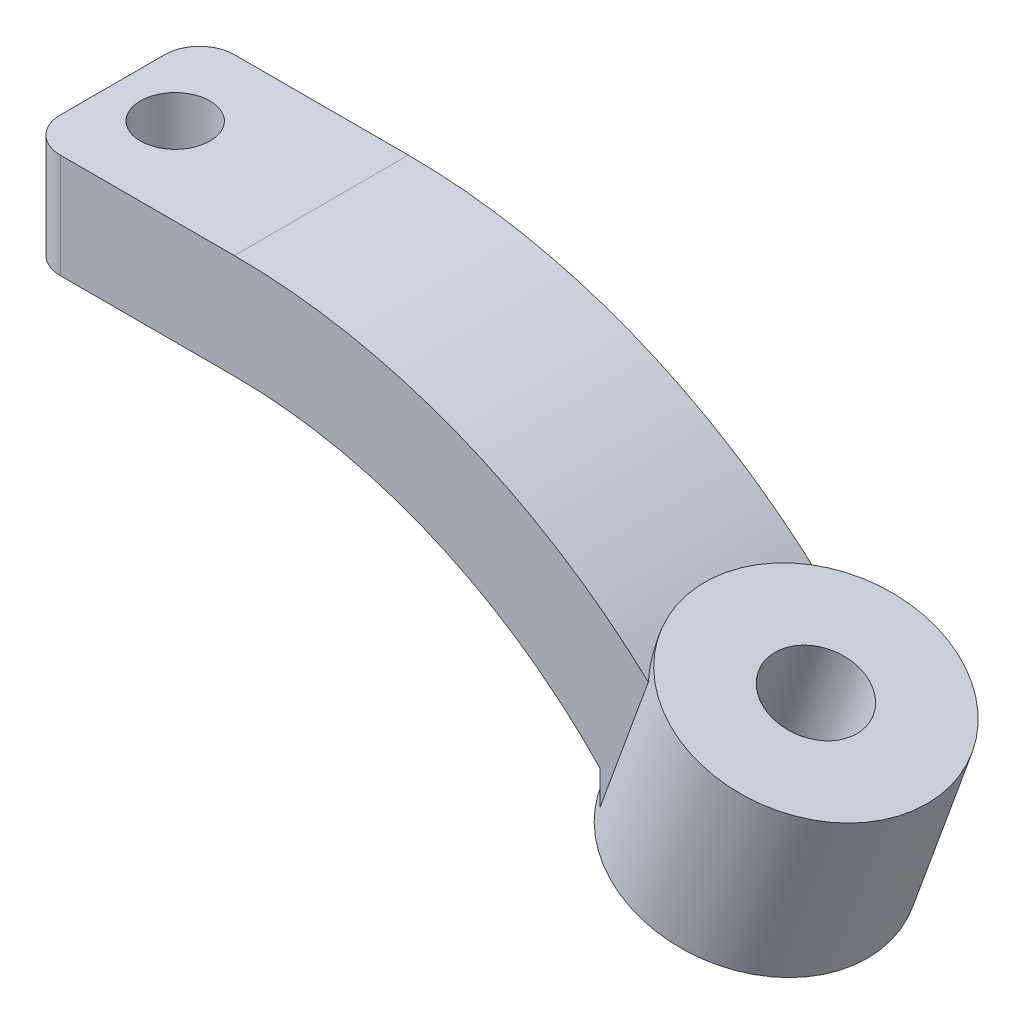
SolidWorks part; units mm, degrees
ref_plane "前视基准面" through (0, 0, 0) normal (0, 0, 1) x (1, 0, 0)
ref_plane "上视基准面" through (0, 0, 0) normal (0, 1, 0) x (1, 0, 0)
ref_plane "右视基准面" through (0, 0, 0) normal (1, 0, 0) x (0, 0, -1)
sketch "草图2" plane through (0, 0, 0) normal (0, 0, 1) x (1, 0, 0)
  line L1 (3, 1.5) -> (-3, 1.5)
  line L2 (3, 1.5) -> (3, -1.5)
  line L3 (3, -1.5) -> (-3, -1.5)
  line L4 (-3, 1.5) -> (-3, -1.5)
  line L5 (3, 1.5) -> (-3, -1.5) construction
  line L6 (3, -1.5) -> (-3, 1.5) construction
  line L7 (17.3634, -6) -> (13.5016, -6)
  arc A0 (3, 1.5) -> (17.3634, -6) centre (3, -16.0037) cw
  arc A1 (3, -1.5) -> (13.5016, -6) centre (3, -16.0037) cw
  arc A2 (3, -1.5) -> (14.9016, -7.7146) centre (3, -16.0037) cw construction
  point P0 (0, 0)
  dimension "D1" = 3
  dimension "D2" = 6
  dimension "D4" = 4.5
  dimension "D3" = 3
extrude "凸台-拉伸1" add sketch "草图2" along normal mid plane 5
sketch "草图4" plane through (0, -1.5, 0) normal (0, -1, 0) x (1, 0, 0)
  line L0 (-3, 2.5) -> (-3, -2.5) construction
  circle A0 centre (-1.2, 0) radius 1
  dimension "D1" = 1.8
  dimension "D2" = 2
extrude "切除-拉伸1" cut sketch "草图4" against normal blind 5
sketch "草图5" plane through (0, 0, 0) normal (0, 0, 1) x (1, 0, 0)
  line L0 (17.6607, -9.0138) -> (13.5016, -7.5)
  line L1 (13.5016, -7.5) -> (13.5016, -6)
  line L2 (13.5016, -6) -> (17.3634, -6)
  line L3 (3, -1.5) -> (-3, -1.5) construction
  arc A0 (17.3634, -6) -> (17.6607, -9.0138) centre (14.3718, -7.8167) cw
  dimension "D3" = 3.5
  dimension "D1" = 20
  dimension "D2" = 1.5
extrude "凸台-拉伸2" add sketch "草图5" along normal mid plane 5
sketch "草图7" plane through (-0.8311, -2.2833, 0) normal (-0.342, -0.9397, 0) x (0.9397, -0.342, 0)
  line L0 (0.008, 0) -> (17.3785, 0) construction
  line L2 (19.6785, 2.5) -> (19.6785, -2.5) construction
  circle A0 centre (17.3785, 0) radius 3.3971
  dimension "D1" = 2.3
extrude "凸台-拉伸3" add sketch "草图7" against normal blind 5
sketch "草图8" plane through (-0.8311, -2.2833, 0) normal (-0.342, -0.9397, 0) x (0.9397, -0.342, 0)
  circle A0 centre (17.3785, 0) radius 1.25
  dimension "D1" = 2.5
extrude "切除-拉伸2" cut sketch "草图8" against normal blind 5
fillet "圆角1" radius 1 2 edges at (-3, 0, -2.5) (-3, 0, 2.5)
